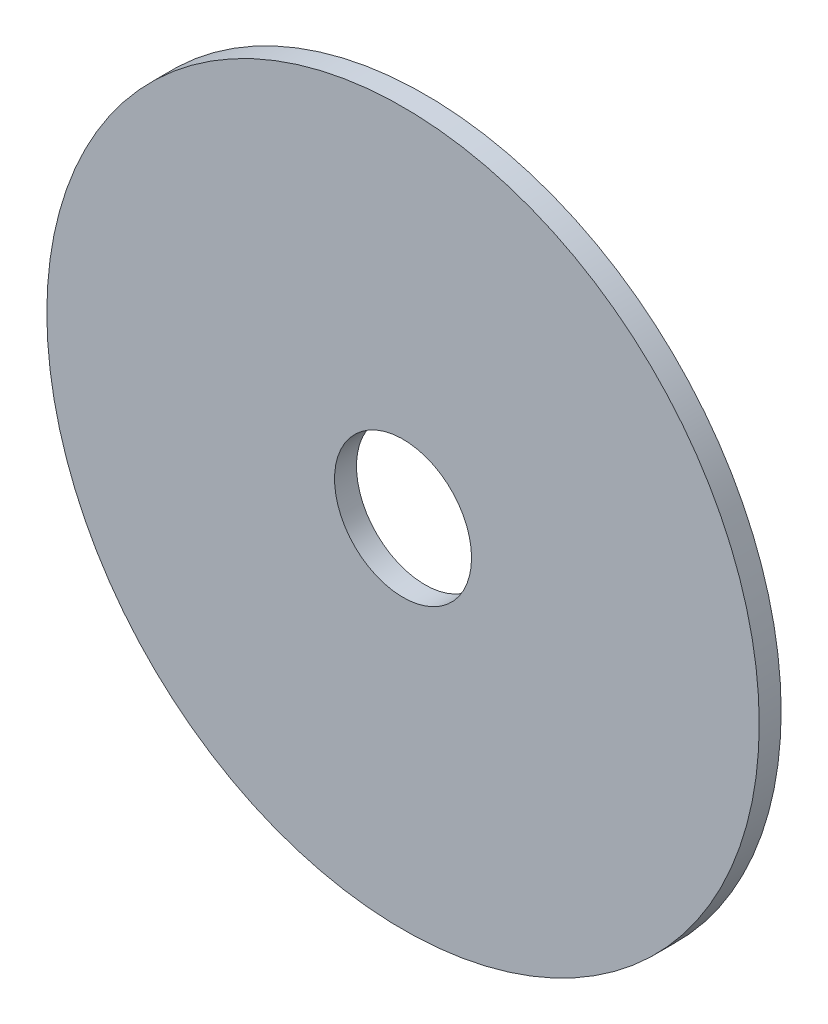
SolidWorks part; units mm, degrees
ref_plane "Plan de face" through (0, 0, 0) normal (0, 0, 1) x (1, 0, 0)
ref_plane "Plan de dessus" through (0, 0, 0) normal (0, 1, 0) x (1, 0, 0)
ref_plane "Plan de droite" through (0, 0, 0) normal (1, 0, 0) x (0, 0, -1)
sketch "Esquisse1" plane through (0, 0, 0) normal (0, 0, 1) x (1, 0, 0)
  circle A0 centre (0, 0) radius 32.5
  circle A1 centre (0, 0) radius 6.25
  dimension "D1" = 12.5
  dimension "D2" = 65
extrude "Extrusion1" add sketch "Esquisse1" along normal blind 2
